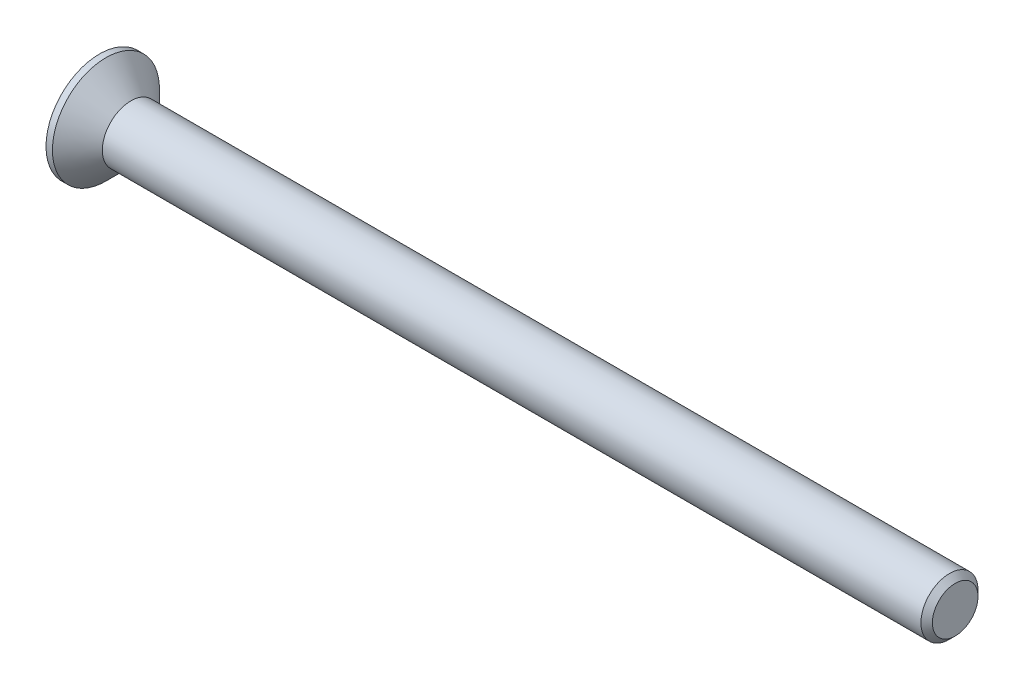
SolidWorks part; units mm, degrees
ref_plane "Front Plane" through (0, 0, 0) normal (0, 0, 1) x (1, 0, 0)
ref_plane "Top Plane" through (0, 0, 0) normal (0, 1, 0) x (1, 0, 0)
ref_plane "Right Plane" through (0, 0, 0) normal (1, 0, 0) x (0, 0, -1)
sketch "Sketch1" plane through (0, 0, 0) normal (0, 0, 1) x (1, 0, 0)
  line L1 (-2.2, 3.75) -> (-2.2, 0)
  line L2 (-2.2, 0) -> (57.8, 0)
  line L3 (57.8, 0) -> (57.8, 2)
  line L4 (57.8, 2) -> (0, 2)
  line L5 (-2.2, 3.75) -> (-1.75, 3.75)
  line L6 (-1.75, 3.75) -> (0, 2)
  dimension "D1" = 2
  dimension "D2" = 45
  dimension "D3" = 2.2
  dimension "D4" = 60
  dimension "D5" = 3.75
revolve "Revolve1" add sketch "Sketch1" angle 360 about L2
chamfer "Chamfer1" distance 0.4 angle 45 1 edges at (57.8, 0, 2)
sketch "Sketch2" plane through (-2.2, 0, 0) normal (-1, 0, 0) x (0, 0, 1)
  line L0 (-0.55, 2.2) -> (0.55, 2.2)
  line L1 (0.55, 2.2) -> (0.55, 0.55)
  line L2 (0.55, 0.55) -> (2.2, 0.55)
  line L3 (2.2, 0.55) -> (2.2, -0.55)
  line L4 (2.2, -0.55) -> (0.55, -0.55)
  line L5 (0.55, -0.55) -> (0.55, -2.2)
  line L6 (0.55, -2.2) -> (-0.55, -2.2)
  line L7 (-0.55, -2.2) -> (-0.55, -0.55)
  line L8 (-0.55, -0.55) -> (-2.2, -0.55)
  line L9 (-2.2, -0.55) -> (-2.2, 0.55)
  line L10 (-2.2, 0.55) -> (-0.55, 0.55)
  line L11 (-0.55, 0.55) -> (-0.55, 2.2)
  point P2 (0, 2.2)
  point P14 (0, -2.2)
  point P15 (2.2, 0)
  point P16 (-2.2, 0)
  dimension "D1" = 4.4
  dimension "D2" = 1.1
extrude "Cut-Extrude1" cut sketch "Sketch2" against normal blind 1.9
